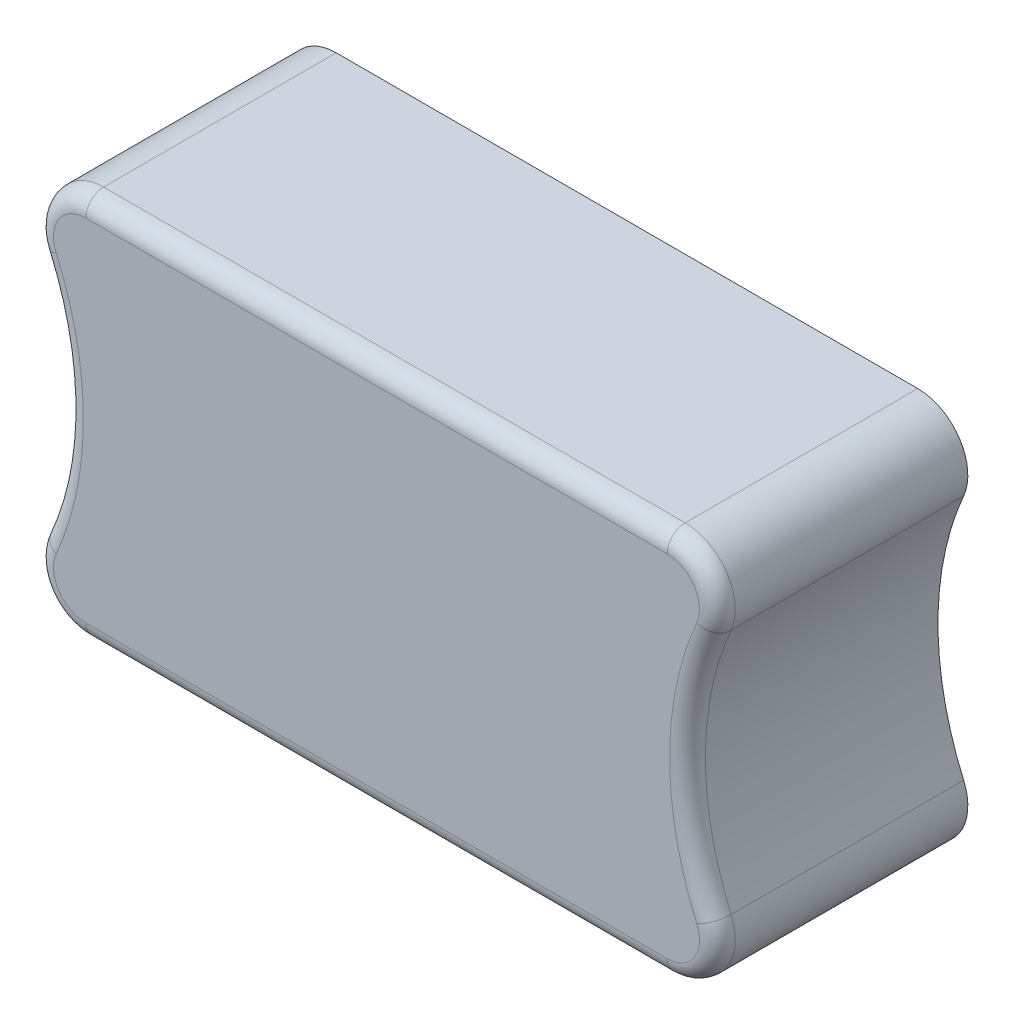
SolidWorks part; units mm, degrees
ref_plane "Alzado" through (0, 0, 0) normal (0, 0, 1) x (1, 0, 0)
ref_plane "Planta" through (0, 0, 0) normal (0, 1, 0) x (1, 0, 0)
ref_plane "Vista lateral" through (0, 0, 0) normal (1, 0, 0) x (0, 0, -1)
sketch "Croquis1" plane through (0, 0, 0) normal (0, 0, 1) x (1, 0, 0)
  line L0 (-40.6318, 27) -> (40.6318, 27) construction
  line L1 (40.6318, -27) -> (-40.6318, -27) construction
  line L2 (-40.6318, 27) -> (40.6318, 27)
  line L3 (40.6318, -27) -> (-40.6318, -27)
  arc A0 (47.0474, 17.2) -> (40.6318, 27) centre (40.6318, 20) ccw construction
  arc A1 (-47.0474, -17.2) -> (-40.6318, -27) centre (-40.6318, -20) ccw construction
  arc A2 (-47.0474, -17.2) -> (-47.0474, 17.2) centre (-86.4575, 0) ccw construction
  arc A3 (-40.6318, 27) -> (-47.0474, 17.2) centre (-40.6318, 20) ccw construction
  arc A4 (47.0474, 17.2) -> (47.0474, -17.2) centre (86.4575, 0) ccw construction
  arc A5 (40.6318, -27) -> (47.0474, -17.2) centre (40.6318, -20) ccw construction
  arc A6 (47.0474, 17.2) -> (40.6318, 27) centre (40.6318, 20) ccw
  arc A7 (-47.0474, -17.2) -> (-40.6318, -27) centre (-40.6318, -20) ccw
  arc A8 (-47.0474, -17.2) -> (-47.0474, 17.2) centre (-86.4575, 0) ccw
  arc A9 (-40.6318, 27) -> (-47.0474, 17.2) centre (-40.6318, 20) ccw
  arc A10 (47.0474, 17.2) -> (47.0474, -17.2) centre (86.4575, 0) ccw
  arc A11 (40.6318, -27) -> (47.0474, -17.2) centre (40.6318, -20) ccw
extrude "Saliente-Extruir2" add sketch "Croquis1" against normal up to vertex (35 mm away)
fillet "Redondeo1" radius 2.5 8 edges at (46.4884, -23.8341, 0) (0, -27, 0) (-46.4884, -23.8341, 0) (-43.4575, 0, 0) (-46.4884, 23.8341, 0) (0, 27, 0) (46.4884, 23.8341, 0) (43.4575, 0, 0)
shell "Vaciado1" thickness 3
